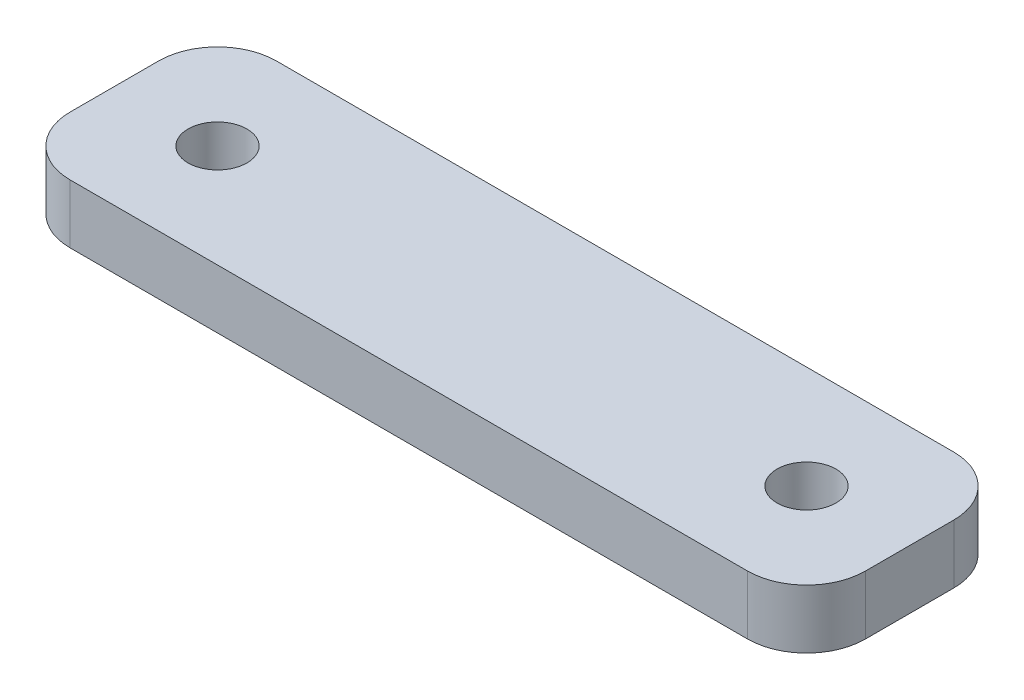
SolidWorks part; units mm, degrees
ref_plane "Plane XZ" through (0, 0, 0) normal (0, 0, 1) x (1, 0, 0)
ref_plane "Plane XY" through (0, 0, 0) normal (0, 1, 0) x (1, 0, 0)
ref_plane "Plane YZ" through (0, 0, 0) normal (1, 0, 0) x (0, 0, -1)
sketch "Sketch1" plane through (0, 0, 0) normal (0, 1, 0) x (1, 0, 0)
  line L0 (0, 4.445) -> (0, -4.445) construction
  line L1 (-17.145, 4.445) -> (17.145, 4.445)
  line L2 (-17.145, 4.445) -> (-17.145, -4.445)
  line L3 (-17.145, -4.445) -> (17.145, -4.445)
  line L4 (17.145, 4.445) -> (17.145, -4.445)
  dimension "D1" = 8.89
  dimension "D3" = 34.29
extrude "Boss-Extrude1" add sketch "Sketch1" along normal blind 2.54
sketch "Sketch4" plane through (0, 2.54, 0) normal (0, 1, 0) x (1, 0, 0)
  line L0 (0, 0) -> (-12.7, 0) construction
  line L1 (0, 0) -> (0, 4.445) construction
  line L2 (17.145, 4.445) -> (-17.145, 4.445) construction
  circle A0 centre (-12.7, 0) radius 1.27
  circle A1 centre (12.7, 0) radius 1.27
  dimension "D1" = 2.54
  dimension "D2" = 25.4
extrude "Cut-Extrude3" cut sketch "Sketch4" against normal through all
fillet "Fillet1" radius 2.54 4 edges at (17.145, 1.27, -4.445) (17.145, 1.27, 4.445) (-17.145, 1.27, 4.445) (-17.145, 1.27, -4.445)
